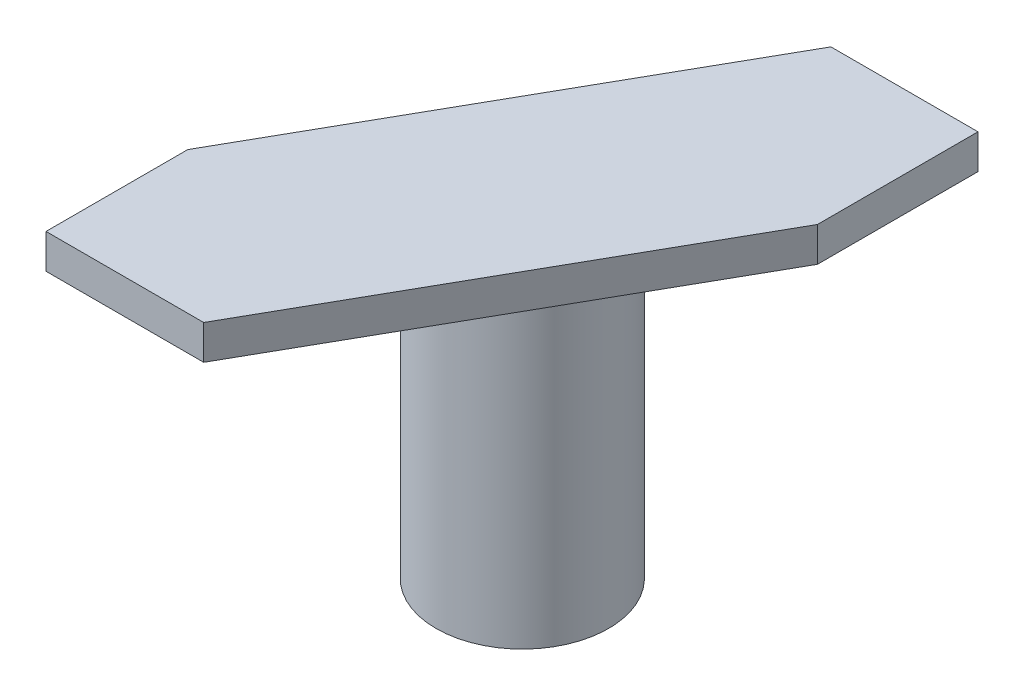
SolidWorks part; units mm, degrees
ref_plane "Płaszczyzna przednia" through (0, 0, 0) normal (0, 0, 1) x (1, 0, 0)
ref_plane "Płaszczyzna górna" through (0, 0, 0) normal (0, 1, 0) x (1, 0, 0)
ref_plane "Płaszczyzna prawa" through (0, 0, 0) normal (1, 0, 0) x (0, 0, -1)
sketch "Szkic1" plane through (0, 0, 0) normal (0, 1, 0) x (1, 0, 0)
  line L0 (1.1272, 4.6511) -> (5.3879, 4.6511)
  line L1 (5.3879, 4.6511) -> (5.3879, 0)
  line L2 (5.3879, 0) -> (-1.0435, -11.3489)
  line L3 (-1.0435, -11.3489) -> (-5.6121, -11.3489)
  line L4 (-5.6121, -11.3489) -> (-5.6121, -7.2411)
  line L5 (-5.6121, -7.2411) -> (1.1272, 4.6511)
  point P6 (4.3536, 0)
  dimension "D1" = 6
  dimension "D2" = 16
  dimension "D3" = 11
extrude "Dodanie-wyciągnięcie1" add sketch "Szkic1" along normal blind 1
sketch "Szkic2" plane through (0, 0, 0) normal (0, 1, 0) x (1, 0, 0)
  circle A0 centre (0, -3.1619) radius 2.5
  dimension "D1" = 5
extrude "Dodanie-wyciągnięcie2" add sketch "Szkic2" against normal blind 9
